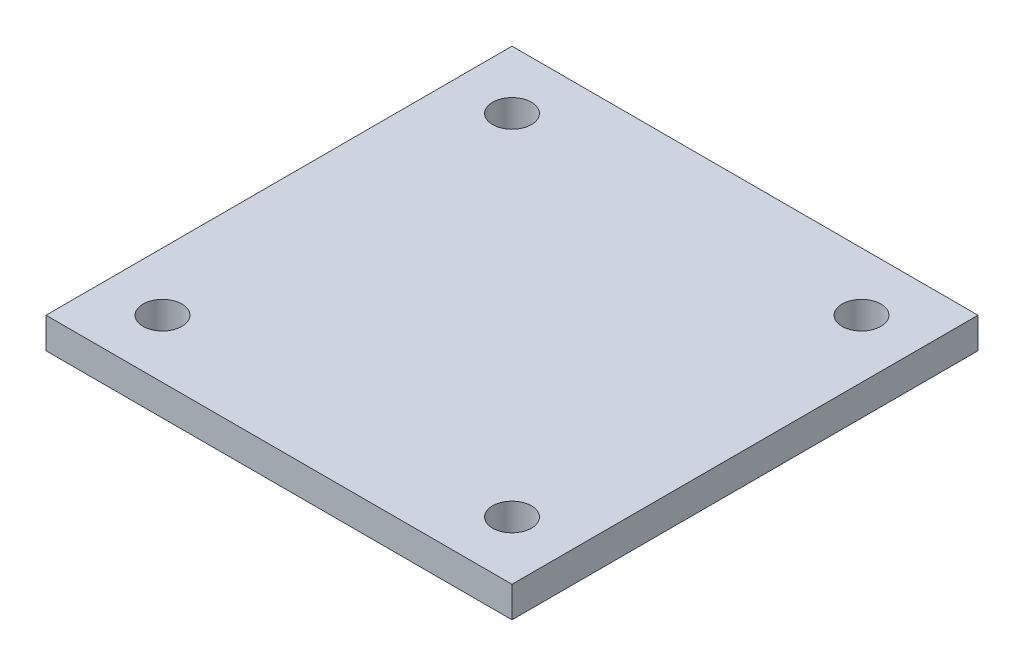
SolidWorks part; units mm, degrees
ref_plane "Plan de face" through (0, 0, 0) normal (0, 0, 1) x (1, 0, 0)
ref_plane "Plan de dessus" through (0, 0, 0) normal (0, 1, 0) x (1, 0, 0)
ref_plane "Plan de droite" through (0, 0, 0) normal (1, 0, 0) x (0, 0, -1)
sketch "Esquisse1" plane through (0, 0, 0) normal (0, 1, 0) x (1, 0, 0)
  line L1 (-12, -12) -> (12, -12)
  line L2 (-12, -12) -> (-12, 12)
  line L3 (-12, 12) -> (12, 12)
  line L4 (12, -12) -> (12, 12)
  line L5 (-12, -12) -> (12, 12) construction
  line L6 (-12, 12) -> (12, -12) construction
  line L7 (-9, -9) -> (9, -9) construction
  line L8 (-9, -9) -> (-9, 9) construction
  line L9 (-9, 9) -> (9, 9) construction
  line L10 (9, -9) -> (9, 9) construction
  line L11 (-9, -9) -> (9, 9) construction
  line L12 (-9, 9) -> (9, -9) construction
  circle A0 centre (-9, 9) radius 1
  circle A1 centre (9, 9) radius 1
  circle A2 centre (-9, -9) radius 1
  circle A3 centre (9, -9) radius 1
  point P0 (0, 0)
  point P6 (0, 0)
  dimension "D3" = 2
  dimension "D1" = 24
  dimension "D2" = 18
extrude "Boss.-Extru.1" add sketch "Esquisse1" along normal blind 1.5875
